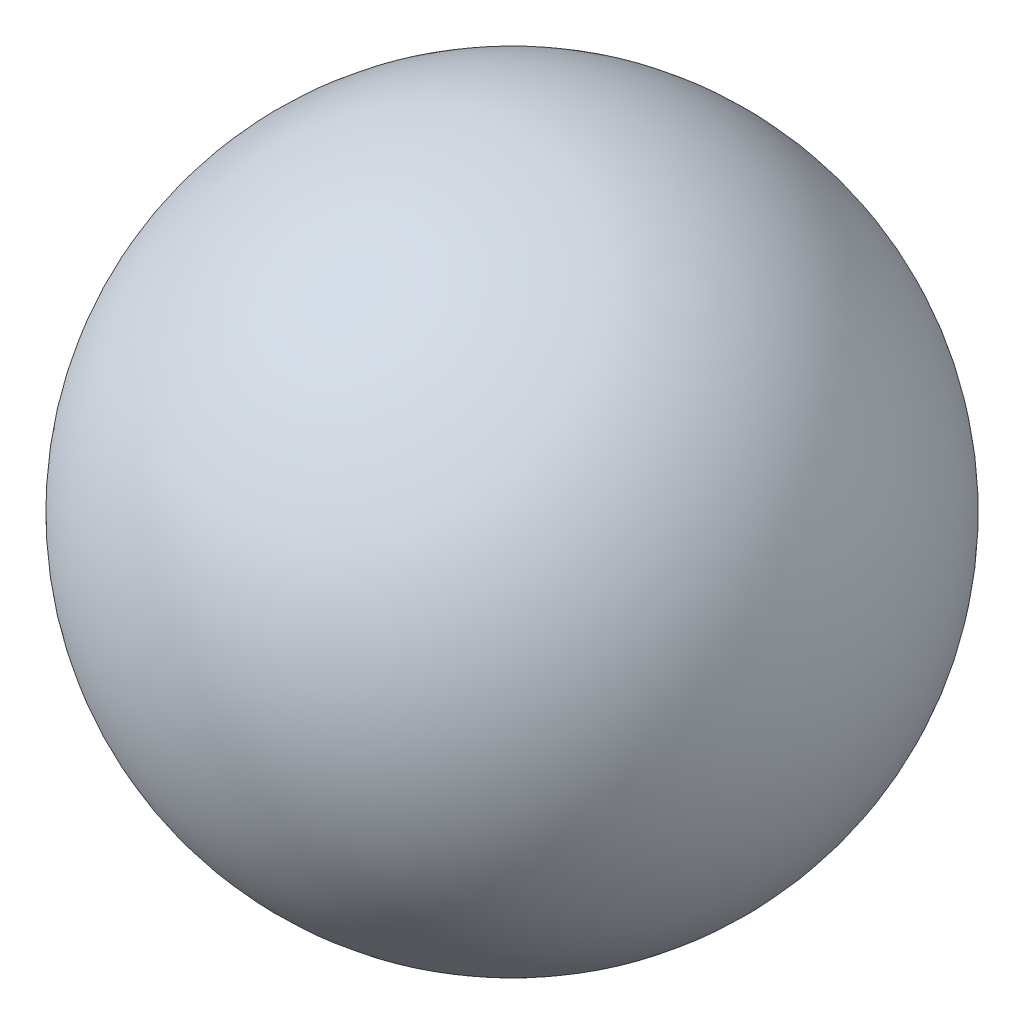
SolidWorks part; units mm, degrees
ref_plane "Face" through (0, 0, 0) normal (0, 0, 1) x (1, 0, 0)
ref_plane "Dessus" through (0, 0, 0) normal (0, 1, 0) x (1, 0, 0)
ref_plane "Droite" through (0, 0, 0) normal (1, 0, 0) x (0, 0, -1)
sketch "Esquisse1" plane through (0, 0, 0) normal (0, 0, 1) x (1, 0, 0)
  line L0 (20.6557, 391.4575) -> (20.6557, 369.1) construction
  line L1 (17.6557, 391.4575) -> (23.6557, 391.4575) construction
  line L2 (-30, 369.1) -> (51.2, 369.1) construction
  line L3 (20.6557, 381.9375) -> (20.6557, 373.9375)
  arc A0 (20.6557, 373.9375) -> (20.6557, 381.9375) centre (20.6557, 377.9375) ccw
  circle A1 centre (20.6557, 377.9375) radius 4 construction
  dimension "D1" = 8
revolve "Révolution1" add sketch "Esquisse1" angle 360 about L0
